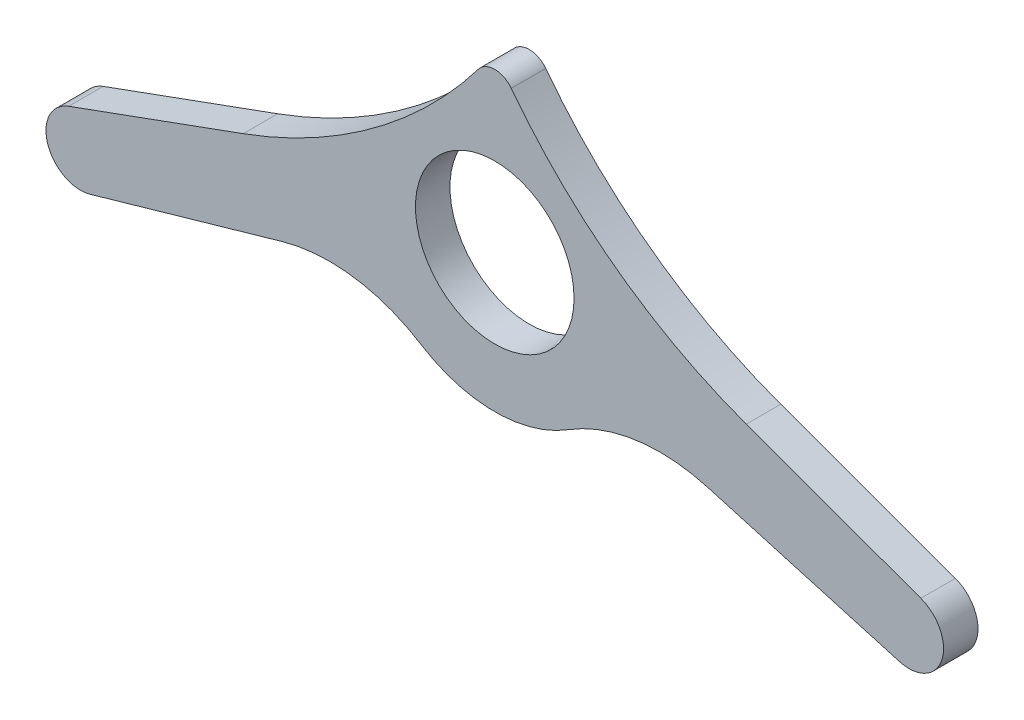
SolidWorks part; units mm, degrees
ref_plane "Front Plane" through (0, 0, 0) normal (0, 0, 1) x (1, 0, 0)
ref_plane "Top Plane" through (0, 0, 0) normal (0, 1, 0) x (1, 0, 0)
ref_plane "Right Plane" through (0, 0, 0) normal (1, 0, 0) x (0, 0, -1)
sketch "Sketch1" plane through (0, 0, 0) normal (0, 0, 1) x (1, 0, 0)
  line L0 (-92.6386, 0) -> (71.1649, 0) construction
  line L1 (0, 0) -> (85.4258, -24.4955) construction
  line L2 (58.7007, -22.0336) -> (30.8635, -14.0515)
  line L3 (61.789, -12.5289) -> (36.4759, -3.3157)
  line L4 (0, 28.0421) -> (0, -26.823) construction
  line L5 (-58.7007, -22.0336) -> (-30.8635, -14.0515)
  line L6 (-61.789, -12.5289) -> (-36.4759, -3.3157)
  circle A0 centre (0, 0) radius 11.5
  circle A1 centre (0, 0) radius 20 construction
  circle A2 centre (0, 0) radius 62.5 construction
  arc A3 (2.3895, 21.8139) -> (-2.3895, 21.8139) centre (0, 20) ccw
  arc A4 (58.5095, -21.9747) -> (61.2637, -12.3697) centre (60.0789, -17.2273) ccw
  arc A5 (30.8635, -14.0515) -> (10.6545, -16.9258) centre (23.9726, -38.083) ccw
  arc A6 (2.3895, 21.8139) -> (36.4759, -3.3157) centre (62.1274, 67.1613) ccw
  arc A7 (10.6545, -16.9258) -> (-10.6545, -16.9258) centre (0, 0) cw
  arc A8 (-30.8635, -14.0515) -> (-10.6545, -16.9258) centre (-23.9726, -38.083) cw
  arc A9 (-58.5095, -21.9747) -> (-61.2637, -12.3697) centre (-60.0789, -17.2273) cw
  arc A10 (-2.3895, 21.8139) -> (-36.4759, -3.3157) centre (-62.1274, 67.1613) cw
  dimension "D1" = 23
  dimension "D2" = 40
  dimension "D3" = 125
  dimension "D5" = 6
  dimension "D6" = 10
  dimension "D7" = 25
  dimension "D9" = 75
  dimension "D4" = 16
  dimension "D8" = 4
extrude "Boss-Extrude1" add sketch "Sketch1" along normal blind 5
